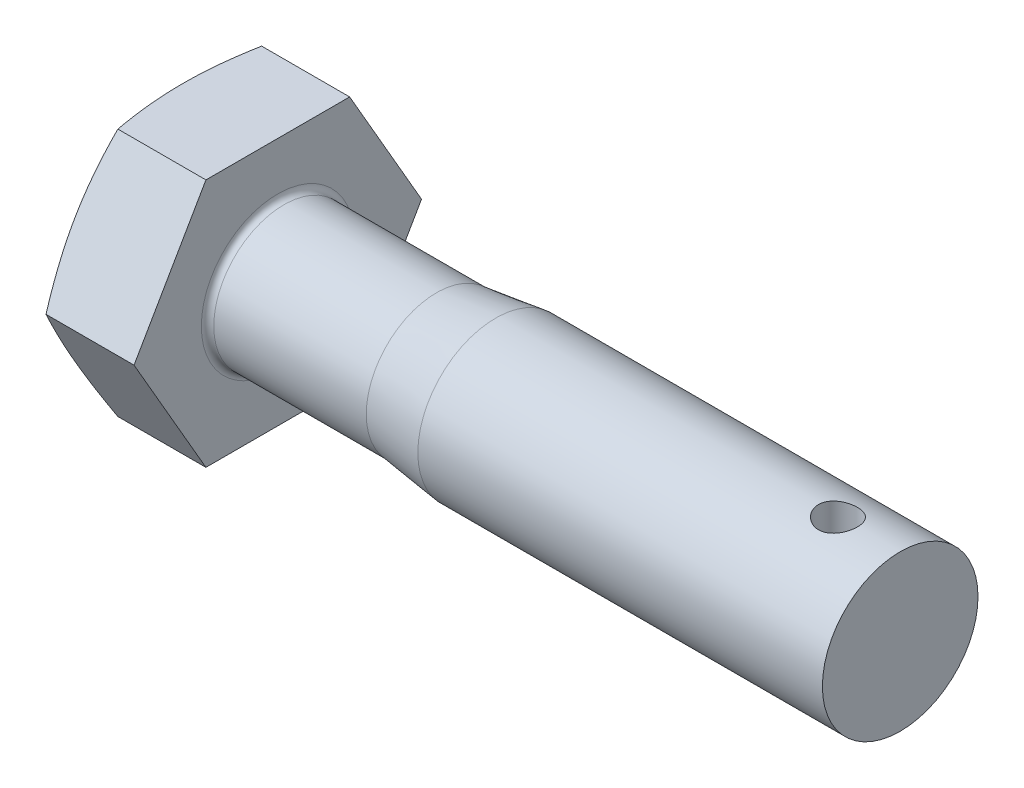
SolidWorks part; units mm, degrees
ref_plane "Front" through (0, 0, 0) normal (0, 0, 1) x (1, 0, 0)
ref_plane "Top" through (0, 0, 0) normal (0, 1, 0) x (1, 0, 0)
ref_plane "Right" through (0, 0, 0) normal (1, 0, 0) x (0, 0, -1)
sketch "Sketch1" plane through (0, 0, 0) normal (1, 0, 0) x (0, 0, -1)
  line L1 (4.6188, -8) -> (9.2376, 0)
  line L2 (9.2376, 0) -> (4.6188, 8)
  line L3 (4.6188, 8) -> (-4.6188, 8)
  line L4 (-4.6188, 8) -> (-9.2376, 0)
  line L5 (-9.2376, 0) -> (-4.6188, -8)
  line L6 (-4.6188, -8) -> (4.6188, -8)
  circle A0 centre (0, 0) radius 8 construction
  dimension "s" = 16
extrude "BaseHead" add sketch "Sketch1" along normal blind 6.4
ref_plane "Plane1" through (20.4, 0, 0) normal (1, 0, 0) x (0, 0, -1)
sketch "Sketch2" plane through (6.4, 0, 0) normal (1, 0, 0) x (0, 0, -1)
  circle A0 centre (0, 0) radius 5
  dimension "d" = 10
extrude "BaseBody" add sketch "Sketch2" along normal blind 40
sketch "Sketch3" plane through (3.1612, 0, 2.6123) normal (0, 1, 0) x (0, 0, -1)
  line L0 (2.6123, 2.0714) -> (2.6123, -1.5224) construction
  line L2 (11.8499, 3.1612) -> (11.8499, 2.4196)
  line L3 (11.8499, 2.4196) -> (9.8123, 3.1612)
  line L5 (9.8123, 3.1612) -> (11.8499, 3.1612)
  dimension "D1" = 20
  dimension "dw" = 14.4
revolve "HeadChamfer" cut sketch "Sketch3" angle 360 about L0
sketch "Sketch4" plane through (0, 0, 0) normal (1, 0, 0) x (0, 0, -1)
  circle A0 centre (0, 0) radius 5.6
  dimension "da" = 11.2
extrude "Cut-Extrude1" cut sketch "Sketch4" along normal blind 1.28
sketch "Sketch5" plane through (-2.9296, 0, 7.9296) normal (0, 1, 0) x (0, 0, -1)
  line L0 (7.9296, -2.9296) -> (7.9296, -19.1832) construction
  line L1 (17.1672, -9.3296) -> (12.5484, -9.3296) construction
  line L2 (12.9296, -23.3296) -> (12.4426, -19.5296)
  line L3 (10.9296, -2.9296) -> (10.9296, -19.1832) construction
  line L4 (12.4426, -19.5296) -> (12.4426, -9.3296)
  line L5 (12.9296, -49.3296) -> (12.9296, -9.3296) construction
  line L6 (12.4426, -9.3296) -> (16.9556, -9.3296)
  line L7 (16.9556, -9.3296) -> (16.9556, -23.3296)
  line L8 (16.9556, -23.3296) -> (12.9296, -23.3296)
  line L9 (2.9296, -49.3296) -> (12.9296, -49.3296) construction
  dimension "D1" = 3
  dimension "ds" = 9.026
  dimension "x" = 3.8
  dimension "D3" = 26
  dimension "D4" = 18.052
revolve "Cut-Revolve1" cut sketch "Sketch5" angle 360 about L0
fillet "HeadFillet" radius 0.4 1 edges at (6.4, 0, 4.513)
sketch "Sketch6" plane through (0, 0, 0) normal (0, 1, 0) x (1, 0, 0)
  line L0 (6.4, -4.6188) -> (6.4, -9.2376) construction
  circle A0 centre (42.4, 0) radius 1.25
  dimension "d1" = 2.5
  dimension "lh" = 36
extrude "Hole" cut sketch "Sketch6" against normal through all and the other way through all
equation "\"D1@Cut-Extrude1\" = 0.2 * \"k@BaseHead\""
equation "\"b@ThreadCosmetic1\" = \"l@BaseBody\" - \"lg@Plane1\""
equation "\"D4@Sketch5\" = 2 * \"ds@Sketch5\""
equation "\"D3@Sketch5\" = \"l@BaseBody\" - \"lg@Plane1\""
